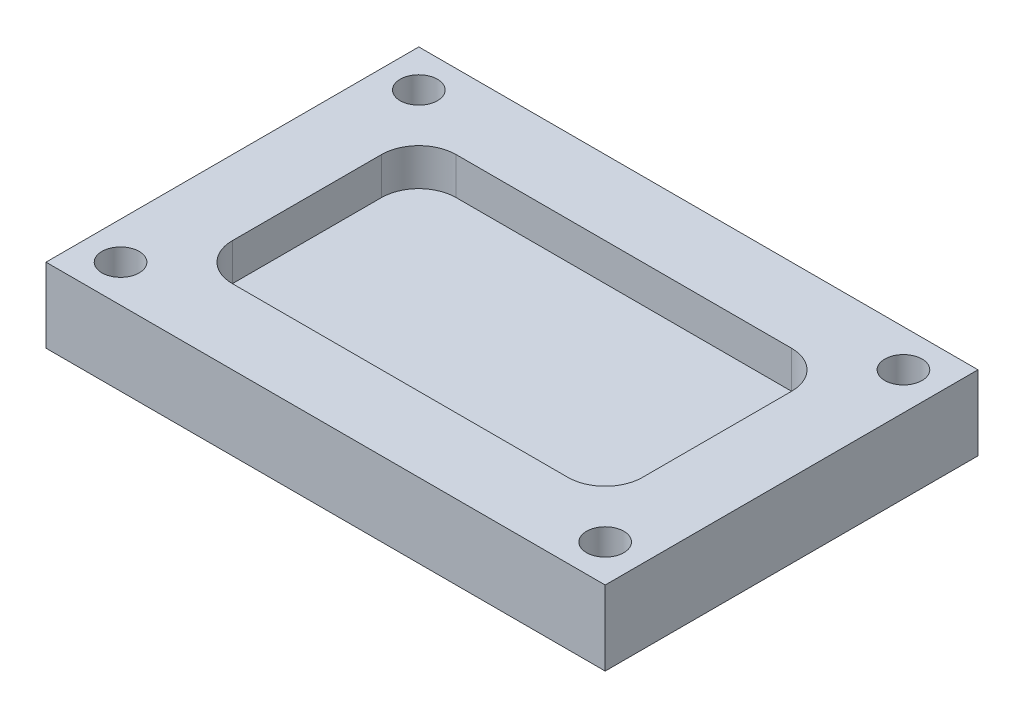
SolidWorks part; units mm, degrees
ref_plane "Front Plane" through (0, 0, 0) normal (0, 0, 1) x (1, 0, 0)
ref_plane "Top Plane" through (0, 0, 0) normal (0, 1, 0) x (1, 0, 0)
ref_plane "Right Plane" through (0, 0, 0) normal (1, 0, 0) x (0, 0, -1)
sketch "Sketch1" plane through (0, 0, 0) normal (0, 1, 0) x (1, 0, 0)
  line L1 (-75, -50) -> (75, -50)
  line L2 (-75, -50) -> (-75, 50)
  line L3 (-75, 50) -> (75, 50)
  line L4 (75, -50) -> (75, 50)
  line L5 (-75, -50) -> (75, 50) construction
  line L6 (-75, 50) -> (75, -50) construction
  point P0 (0, 0)
  dimension "D1" = 100
  dimension "D2" = 150
extrude "Boss-Extrude1" add sketch "Sketch1" along normal blind 20
sketch "Sketch2" plane through (0, 20, 0) normal (0, 1, 0) x (1, 0, 0)
  line L0 (-75, -50) -> (75, -50) construction
  line L1 (-75, 50) -> (-75, -50) construction
  line L2 (0, 0) -> (0, 69.85) construction
  line L3 (0, 0) -> (99.0601, 0) construction
  line L4 (99.0601, 0) -> (99.0601, 0.3599) construction
  point P0 (-65, -40)
  point P8 (-65, 40)
  point P11 (65, -40)
  point P12 (65, 40)
  dimension "D1" = 10
  dimension "D2" = 10
hole_wizard "Ø10.0mm Dowel Hole1" positions "3DSketch1" profile "Sketch3" hole size "Ø10.0" standard "ANSI Metric"
sketch3d "3DSketch1"
  point P0 (-65, 20, -40)
  point P3 (-65, 20, 40)
  point P6 (65, 20, 40)
  point P9 (65, 20, -40)
sketch "Sketch3" plane through (-65, 20, -40) normal (1, 0, 0) x (0, 0, 1)
  line L0 (0, 0) -> (0, 13.0043)
  line L1 (0, 13.0043) -> (5, 10)
  line L2 (5, 10) -> (5, 0)
  line L5 (5, 0) -> (0, 0)
  line L10 (0, 13.0043) -> (-5, 10) construction
  line L11 (0, -6.35) -> (0, 107.95) construction
  dimension "Hole Dia." = 10
  dimension "Hole Depth" = 10
  dimension "Drill Angle" = 118
sketch "Sketch4" plane through (0, 20, 0) normal (0, 1, 0) x (1, 0, 0)
  line L15 (55, -30) -> (55, 30)
  line L16 (55, 30) -> (-55, 30)
  line L17 (-55, -30) -> (55, -30)
  line L18 (-55, 30) -> (-55, -30)
  line L19 (55, -20) -> (55, 20)
  line L20 (45, 30) -> (-45, 30)
  line L21 (-45, -30) -> (45, -30)
  line L22 (-55, 20) -> (-55, -20)
  arc A0 (55, -20) -> (45, -30) centre (45, -20) cw
  arc A1 (55, 20) -> (45, 30) centre (45, 20) ccw
  arc A2 (-45, -30) -> (-55, -20) centre (-45, -20) cw
  arc A3 (-45, 30) -> (-55, 20) centre (-45, 20) ccw
  point P0 (0, 0)
  dimension "D2" = 10
  dimension "D1" = 20
extrude "Cut-Extrude1" cut sketch "Sketch4" against normal blind 10
